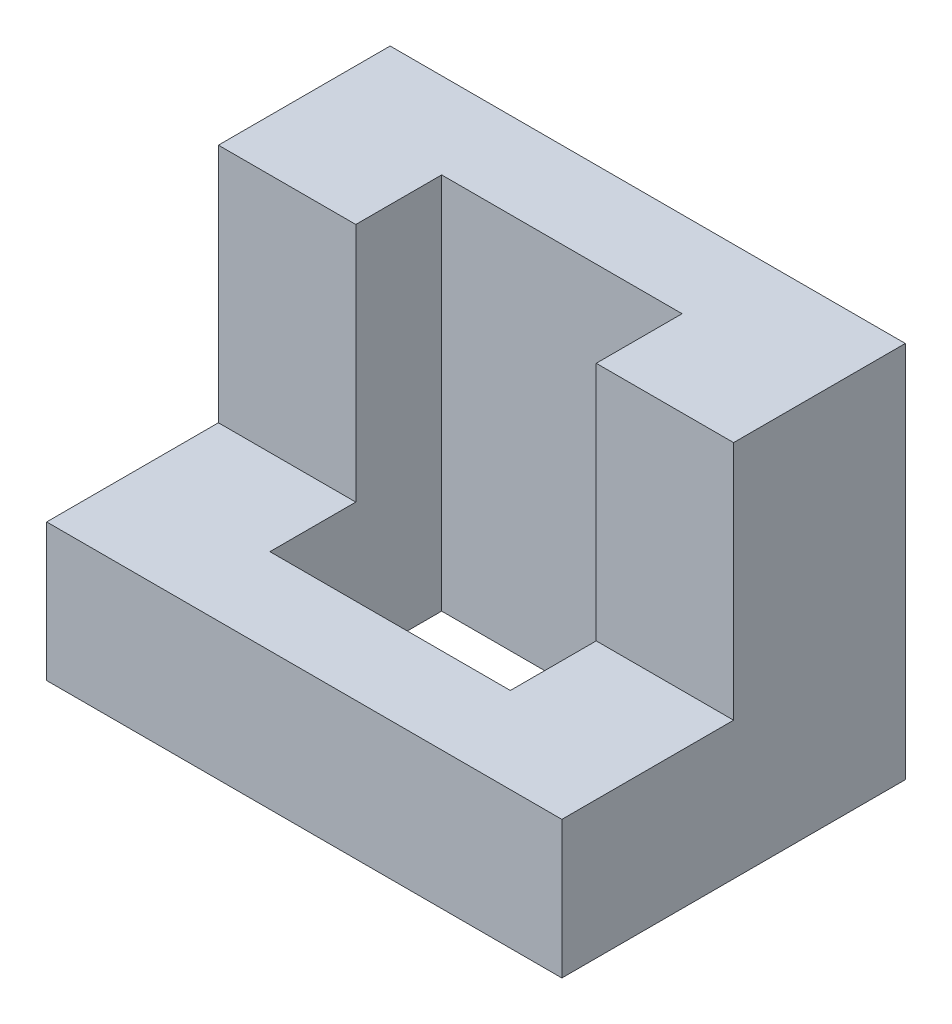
SolidWorks part; units mm, degrees
ref_plane "前视基准面" through (0, 0, 0) normal (0, 0, 1) x (1, 0, 0)
ref_plane "上视基准面" through (0, 0, 0) normal (0, 1, 0) x (1, 0, 0)
ref_plane "右视基准面" through (0, 0, 0) normal (1, 0, 0) x (0, 0, -1)
sketch "草图1" plane through (0, 0, 0) normal (0, 1, 0) x (1, 0, 0)
  line L1 (0, 0) -> (30, 0)
  line L2 (0, 0) -> (0, 20)
  line L3 (0, 20) -> (30, 20)
  line L4 (30, 0) -> (30, 20)
  dimension "D1" = 30
  dimension "D2" = 20
extrude "拉伸1" add sketch "草图1" along normal blind 8
sketch "草图2" plane through (0, 8, 0) normal (0, 1, 0) x (1, 0, 0)
  line L0 (8, 15) -> (22, 15)
  line L1 (0, 20) -> (30, 20)
  line L2 (0, 20) -> (0, 10)
  line L3 (0, 10) -> (8, 10)
  line L4 (8, 15) -> (8, 10)
  line L6 (30, 20) -> (30, 10)
  line L7 (30, 10) -> (22, 10)
  line L8 (22, 15) -> (22, 10)
  line L9 (30, 20) -> (0, 20) construction
  dimension "D1" = 14
  dimension "D2" = 8
  dimension "D3" = 10
  dimension "D4" = 5
extrude "拉伸2" add sketch "草图2" along normal blind 14
sketch "草图3" plane through (0, 8, 0) normal (0, 1, 0) x (1, 0, 0)
  line L0 (0, 0) -> (30, 0) construction
  line L1 (8, 15) -> (22, 15)
  line L2 (8, 15) -> (8, 5)
  line L3 (8, 5) -> (22, 5)
  line L4 (22, 15) -> (22, 5)
  line L5 (22, 15) -> (22, 10) construction
  dimension "D1" = 5
extrude "切除-拉伸1" cut sketch "草图3" against normal through all
